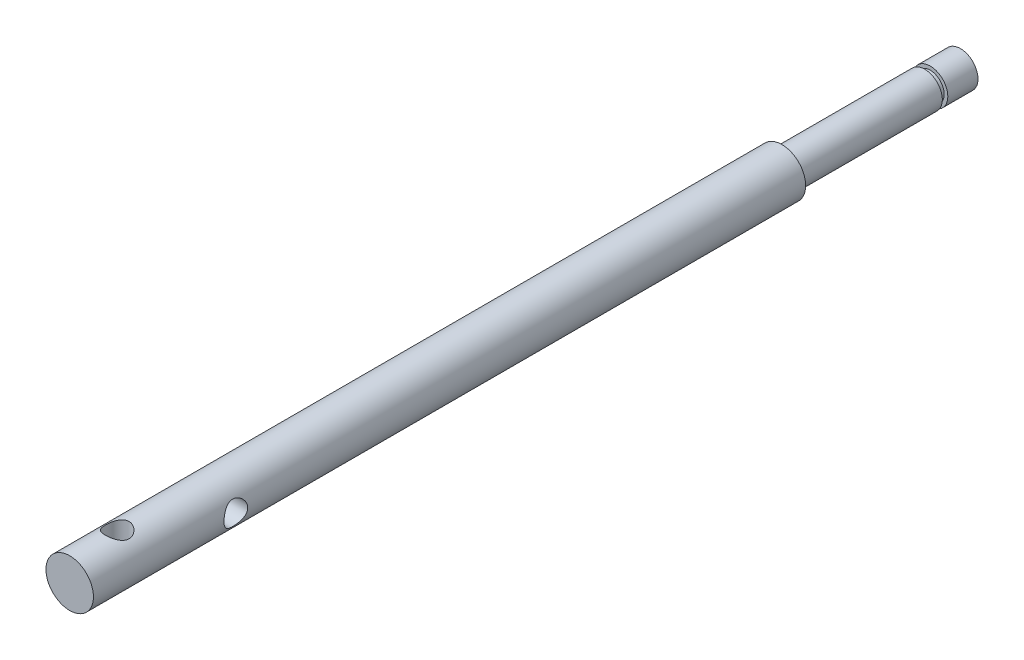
SolidWorks part; units mm, degrees
ref_plane "Front" through (0, 0, 0) normal (0, 0, 1) x (1, 0, 0)
ref_plane "Plane2" through (0, 0, 0) normal (0, 1, 0) x (1, 0, 0)
ref_plane "Right" through (0, 0, 0) normal (1, 0, 0) x (0, 0, -1)
sketch "Sketch1" plane through (0, 0, 0) normal (0, 0, 1) x (1, 0, 0)
  circle A0 centre (0, 0) radius 2.3495
  dimension "D1" = 4.699
extrude "Base-Extrude" add sketch "Sketch1" along normal blind 23.876
ref_plane "Plane6" through (0, 0, 29.845) normal (-1, 0, 0) x (0, 1, 0)
sketch "Sketch12" plane through (0, 0, 0) normal (1, 0, 0) x (0, 0, -1)
  line L0 (-4.0386, 2.681) -> (-4.7752, 2.681)
  line L1 (-23.876, 2.3495) -> (-23.876, -2.3495) construction
  line L2 (-4.0386, 2.681) -> (-4.0386, 1.8669)
  line L3 (-4.7752, 1.8669) -> (-4.0386, 1.8669)
  line L4 (-4.7752, 1.8669) -> (-4.7752, 2.681)
  line L7 (0, 0) -> (-11.4517, 0) construction
  dimension "D1" = 0.7366
  dimension "D2" = 19.1008
  dimension "D4" = 1.8669
revolve "SnapRingGroove" cut sketch "Sketch12" angle 360 about L7
sketch "Sketch13" plane through (0, 0, 23.876) normal (0, 0, 1) x (1, 0, 0)
  circle A0 centre (0, 0) radius 3.175
  dimension "D1" = 6.35
extrude "Shank" add sketch "Sketch13" along normal blind 95.25
sketch "Sketch14" plane through (0, 0, 0) normal (0, 1, 0) x (1, 0, 0)
  line L0 (0, -119.126) -> (0, -23.876) construction
  line L1 (-3.175, -119.126) -> (3.175, -119.126) construction
  circle A0 centre (0, -112.776) radius 1.5875
  dimension "D1" = 6.35
extrude "Cut-Extrude1" cut sketch "Sketch14" against normal mid plane 7.62
sketch "Sketch15" plane through (0, 0, 0) normal (1, 0, 0) x (0, 0, -1)
  line L0 (-119.126, 0) -> (-23.876, 0) construction
  line L1 (-119.126, 3.175) -> (-119.126, -3.175) construction
  circle A0 centre (-100.076, 0) radius 1.5875
  dimension "D1" = 19.05
extrude "Cut-Extrude2" cut sketch "Sketch15" against normal mid plane 7.62
